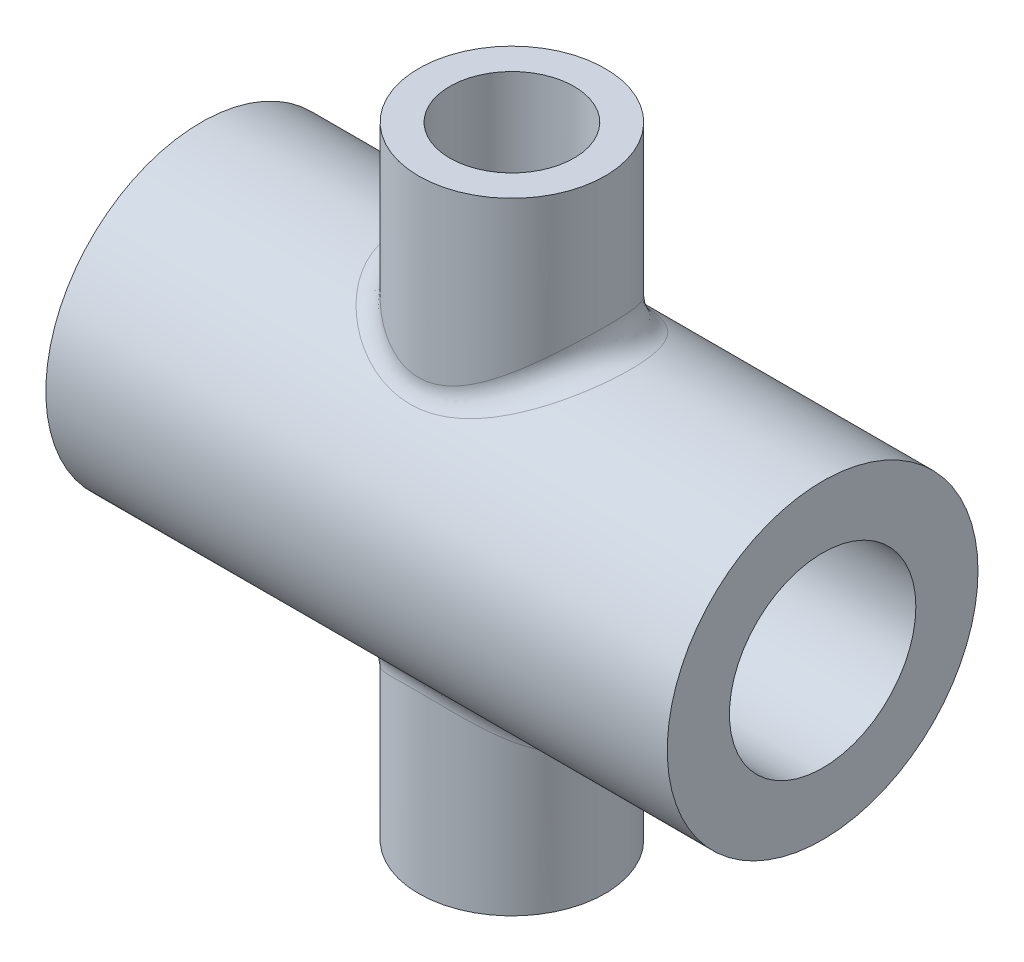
SolidWorks part; units mm, degrees
ref_plane "Front" through (0, 0, 0) normal (0, 0, 1) x (1, 0, 0)
ref_plane "Top" through (0, 0, 0) normal (0, 1, 0) x (1, 0, 0)
ref_plane "Right" through (0, 0, 0) normal (1, 0, 0) x (0, 0, -1)
sketch "Sketch1" plane through (0, 0, 0) normal (1, 0, 0) x (0, 0, -1)
  circle A0 centre (0, 0) radius 50
  dimension "D1" = 100
extrude "Base-Extrude" add sketch "Sketch1" along normal mid plane 200
sketch "Sketch2" plane through (0, 0, 0) normal (0, 1, 0) x (1, 0, 0)
  circle A0 centre (0, 0) radius 30
  dimension "D1" = 60
extrude "Boss-Extrude1" add sketch "Sketch2" along normal mid plane 200
sketch "Sketch3" plane through (0, 100, 0) normal (0, 1, 0) x (-1, 0, 0)
  circle A0 centre (0, 0) radius 20
  dimension "D1" = 40
extrude "Cut-Extrude1" cut sketch "Sketch3" against normal through all
sketch "Sketch4" plane through (100, 0, 0) normal (1, 0, 0) x (0, 0, -1)
  circle A0 centre (0, 0) radius 30
  dimension "D1" = 60
extrude "Cut-Extrude2" cut sketch "Sketch4" against normal through all
fillet "Fillet1" radius 8 2 edges at (0.0649, -40.0001, 29.9999) (-0.0649, 40.0001, 29.9999)
